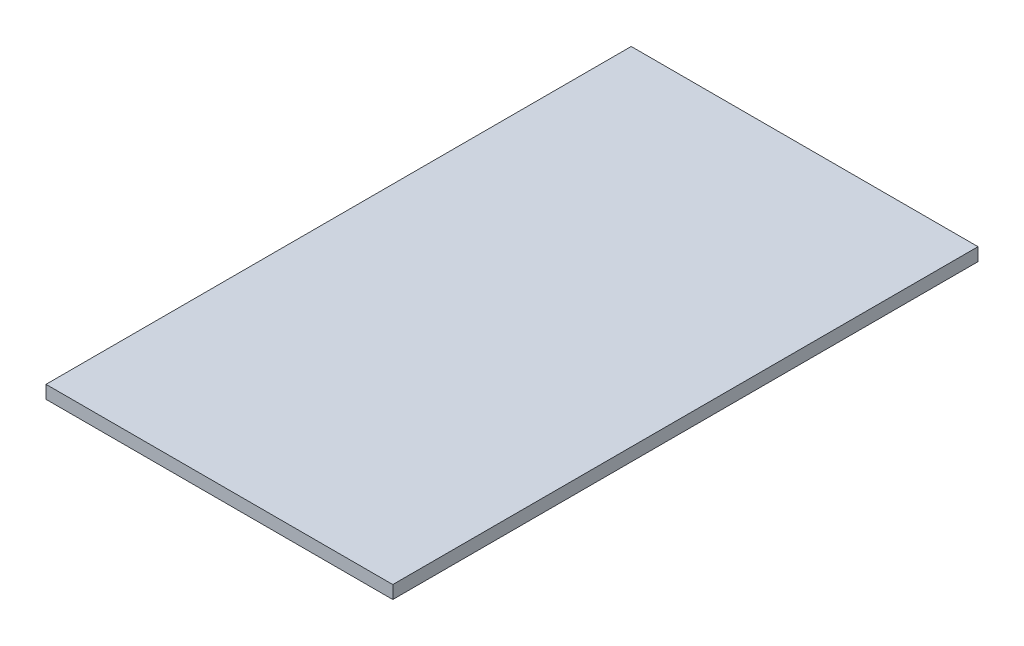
SolidWorks part; units mm, degrees
ref_plane "Front" through (0, 0, 0) normal (0, 0, 1) x (1, 0, 0)
ref_plane "Top" through (0, 0, 0) normal (0, 1, 0) x (1, 0, 0)
ref_plane "Right" through (0, 0, 0) normal (1, 0, 0) x (0, 0, -1)
sketch "Sketch1" plane through (0, 0, 0) normal (0, 0, 1) x (1, 0, 0)
  line L1 (0, 0) -> (40, 0)
  line L2 (0, 0) -> (0, 1.5)
  line L3 (0, 1.5) -> (40, 1.5)
  line L4 (40, 0) -> (40, 1.5)
  dimension "D1" = 40
  dimension "D2" = 1.5
extrude "Extrude1" add sketch "Sketch1" along normal blind 67.5
